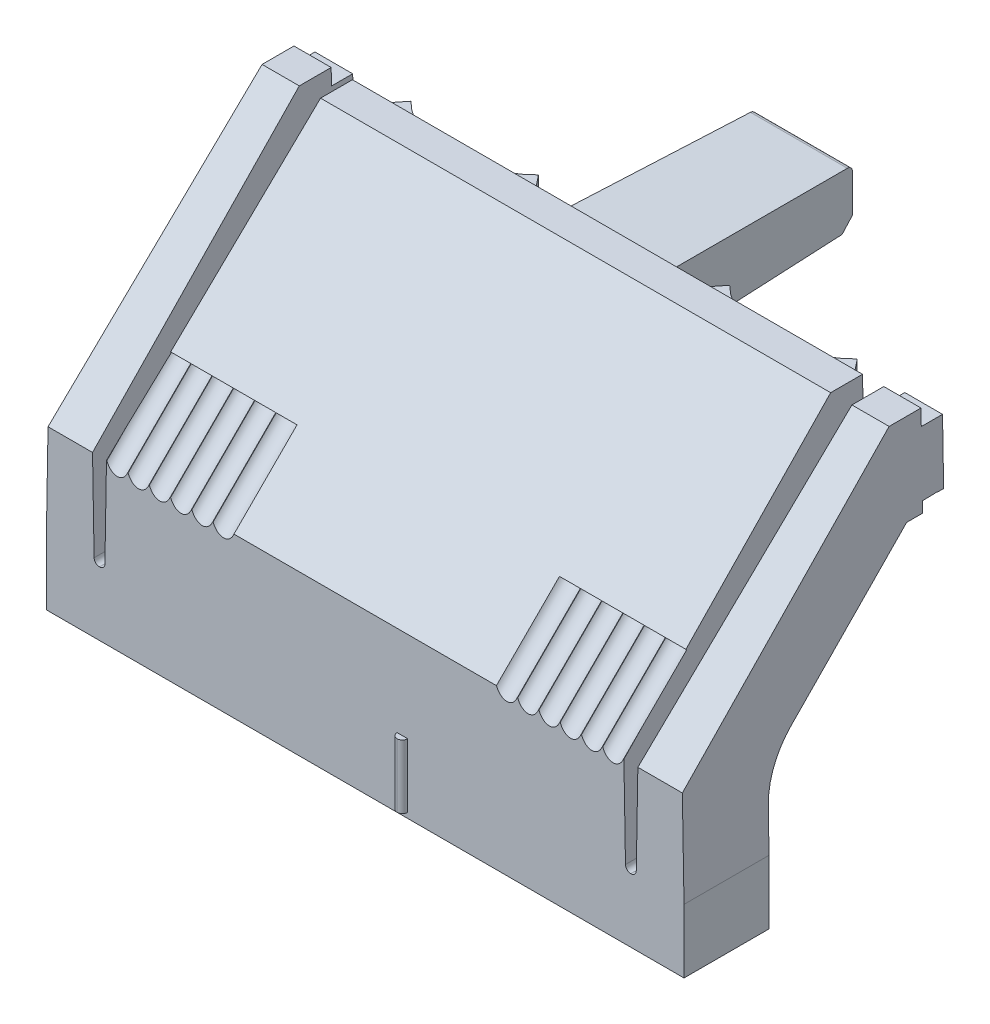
SolidWorks part; units mm, degrees
ref_plane "Plan de face" through (0, 0, 0) normal (0, 0, 1) x (1, 0, 0)
ref_plane "Plan de dessus" through (0, 0, 0) normal (0, 1, 0) x (1, 0, 0)
ref_plane "Plan de droite" through (0, 0, 0) normal (1, 0, 0) x (0, 0, -1)
sketch "Esquisse1" plane through (0, 0, 0) normal (1, 0, 0) x (0, 0, -1)
  line L0 (-4, -15) -> (4, -15)
  line L1 (-4, -15) -> (-4, 0)
  line L2 (-4, 0) -> (15.799, 19.799)
  line L3 (15.799, 19.799) -> (18.799, 19.799)
  line L4 (18.799, 19.799) -> (18.799, 4.508) construction
  line L5 (18.799, 19.799) -> (18.799, 18.299)
  line L6 (4, -15) -> (4, 11.299) construction
  line L7 (17.299, 11.299) -> (2.5901, -3.4099) construction
  line L8 (18.799, 11.299) -> (17.299, 11.299)
  line L9 (17.299, 11.299) -> (4, -1.8505)
  line L10 (4, -1.8505) -> (4, -15)
  line L11 (17.299, 15.299) -> (39.1771, 15.299) construction
  line L12 (18.799, 18.299) -> (37.299, 18.299)
  line L13 (18.799, 12.299) -> (37.299, 12.299)
  line L14 (37.299, 18.299) -> (37.299, 12.299)
  line L15 (18.799, 12.299) -> (18.799, 11.299)
  dimension "D1" = 8
  dimension "D2" = 15
  dimension "D3" = 4
  dimension "D4" = 15
  dimension "D5" = 28
  dimension "D6" = 45
  dimension "D7" = 3
  dimension "D8" = 8.5
  dimension "D9" = 18.7022
  dimension "D10" = 4.5
  dimension "D11" = 1.5
  dimension "D12" = 18.5
  dimension "D13" = 1.5
  dimension "D14" = 3
  dimension "D15" = 1
extrude "Extrusion1" add sketch "Esquisse1" along normal mid plane 60
sketch "Esquisse2" plane through (0, 18.299, 0) normal (0, 1, 0) x (-1, 0, 0)
  line L0 (0, 0) -> (0, -49.2838) construction
  line L1 (-5, -37.299) -> (5, -37.299)
  line L2 (-30, -37.299) -> (30, -37.299) construction
  line L3 (5, -37.299) -> (5, -18.799)
  line L4 (-30, -18.799) -> (30, -18.799) construction
  line L5 (5, -18.799) -> (7, -18.799)
  line L6 (7, -18.799) -> (9, -21.299)
  line L7 (9, -21.299) -> (21, -21.299)
  line L8 (21, -21.299) -> (23, -18.799)
  line L9 (23, -18.799) -> (25, -18.799)
  line L10 (25, -18.799) -> (25, -20.799)
  line L11 (25, -20.799) -> (32.5439, -20.799)
  line L13 (32.5439, -20.799) -> (32.5439, -41.148)
  line L14 (32.5439, -41.148) -> (-32.5439, -41.148)
  line L15 (-5, -18.799) -> (-7, -18.799)
  line L16 (-7, -18.799) -> (-9, -21.299)
  line L17 (-9, -21.299) -> (-21, -21.299)
  line L18 (-21, -21.299) -> (-23, -18.799)
  line L19 (-23, -18.799) -> (-25, -18.799)
  line L20 (-25, -18.799) -> (-25, -20.799)
  line L21 (-25, -20.799) -> (-32.5439, -20.799)
  line L22 (-32.5439, -20.799) -> (-32.5439, -41.148)
  line L23 (-5, -37.299) -> (-5, -18.799)
  point P3 (0, -41.148)
  point P29 (0, -37.299)
  dimension "D1" = 5
  dimension "D2" = 2
  dimension "D3" = 4
  dimension "D4" = 2.5
  dimension "D5" = 12
  dimension "D6" = 14
  dimension "D7" = 2
  dimension "D8" = 2
  dimension "D9" = 20.349
  dimension "D10" = 32.5439
extrude "Enlèv. mat.-Extru.1" cut sketch "Esquisse2" against normal through all
sketch "Esquisse3" plane through (0, 18.299, 0) normal (0, 1, 0) x (-1, 0, 0)
  line L0 (0, 0) -> (0, -43.032) construction
  line L1 (9, -21.299) -> (9, -24.2102)
  line L2 (9, -24.2102) -> (21, -24.2102)
  line L3 (21, -24.2102) -> (21, -21.299)
  line L4 (-21, -24.2102) -> (-21, -21.299)
  line L5 (-9, -24.2102) -> (-21, -24.2102)
  line L6 (-9, -21.299) -> (-9, -24.2102)
  arc A0 (9, -21.299) -> (21, -21.299) centre (15, -27.3198) cw
  arc A1 (-9, -21.299) -> (-21, -21.299) centre (-15, -27.3198) ccw
  dimension "D1" = 8.5
  dimension "D2" = 2.9113
extrude "Enlèv. mat.-Extru.2" cut sketch "Esquisse3" against normal through all
draft "Dépouille1" type of draft neutral plane draft angle 1.4 faces to draft 2 parameters "D1"=1.4
draft "Dépouille2" type of draft neutral plane draft angle 1.4 faces to draft 2 parameters "D1"=1.4
chamfer "Chanfrein1" distance 1 angle 45 1 edges at (0, 12.7511, -37.299)
sketch "Esquisse4" plane through (0, 11.8325, 0.2892) normal (0, -0.9997, -0.0244) x (1, 0, 0)
  line L0 (0, 0) -> (0, -42.5855) construction
  line L1 (4.5479, -37.6244) -> (-4.5479, -37.6244) construction
  line L2 (2.5, -31.6244) -> (-2.5, -31.6244)
  line L3 (2.5, -31.6244) -> (2.5, -34.6244)
  line L4 (2.5, -34.6244) -> (-2.5, -34.6244)
  line L5 (-2.5, -31.6244) -> (-2.5, -34.6244)
  dimension "D1" = 3
  dimension "D2" = 3
  dimension "D3" = 5
  dimension "D4" = 5
extrude "Enlèv. mat.-Extru.3" cut sketch "Esquisse4" against normal blind 3
fillet "Congé1" radius 0.5 1 edges at (0, 17.8469, -37.299)
sketch "Esquisse5" plane through (0, 0, 4) normal (0, 0, 1) x (1, 0, 0)
  line L0 (0, 23.5106) -> (0, -19.7744) construction
  line L1 (-29.5, 19.799) -> (-26, 19.799)
  line L2 (30, 19.799) -> (-30, 19.799) construction
  line L3 (-30, -9) -> (-29.5, 19.799)
  line L6 (-30, 0) -> (-30, -15) construction
  line L7 (30, -15) -> (-30, -15) construction
  line L8 (-30, 19.799) -> (-30, 0) construction
  line L9 (-26, 19.799) -> (-25.5, -9)
  line L10 (-24.5, -9) -> (-24, 19.799)
  line L11 (-25.5, -9) -> (-24.5, -9)
  line L12 (-30, -9) -> (-30, 28.654)
  line L13 (-30, 28.654) -> (-24, 28.654)
  line L14 (-24, 28.654) -> (-24, 19.799)
  line L15 (25.5, -9) -> (24.5, -9)
  line L16 (24, 28.654) -> (24, 19.799)
  line L17 (24.5, -9) -> (24, 19.799)
  line L18 (26, 19.799) -> (25.5, -9)
  line L19 (29.5, 19.799) -> (26, 19.799)
  line L20 (30, 28.654) -> (24, 28.654)
  line L21 (30, -9) -> (29.5, 19.799)
  line L22 (30, -9) -> (30, 28.654)
  dimension "D1" = 6
  dimension "D2" = 0.5
  dimension "D3" = 6
  dimension "D4" = 1
  dimension "D5" = 6
  dimension "D6" = 3.5
  dimension "D7" = 2
  dimension "D8" = 4.5
  dimension "D9" = 8.855
extrude "Enlèv. mat.-Extru.4" cut sketch "Esquisse5" against normal through all
fillet "Congé2" radius 0.5 4 edges at (25.5, -9, 0) (24.5, -9, 0) (-24.5, -9, 0) (-25.5, -9, 0)
sketch "Esquisse8" plane through (0, -2.9356, -2.9026) normal (0, -0.7111, -0.7031) x (1, 0, 0)
  line L0 (0, 15.8392) -> (0, -27.2885) construction
  line L1 (24, -27.2885) -> (-24, -27.2885) construction
  line L2 (24.3759, -1.5433) -> (-24.3759, -1.5433) construction
  line L3 (2, -23.0469) -> (-2, -23.0469)
  line L4 (2, -23.0469) -> (2, 9.9625)
  line L5 (2, 9.9625) -> (-2, 9.9625)
  line L6 (-2, -23.0469) -> (-2, 9.9625)
  dimension "D1" = 4
  dimension "D2" = 33.0094
  dimension "D3" = 2
  dimension "D4" = 11.5058
extrude "Extrusion3" add sketch "Esquisse8" along normal blind 7
sketch "Esquisse9" plane through (-2, 0, 0) normal (-1, 0, 0) x (0, 0, 1)
  line L0 (-18.799, 12.299) -> (-18.799, 2.9381)
  line L1 (-4, -11.6945) -> (-24.2127, 8.291) construction
  line L2 (-18.799, 12.299) -> (-20.2156, 12.3336)
  line L3 (-20.2156, 12.3336) -> (-26.1871, 6.2942)
  line L4 (-14.2087, -9) -> (0, -9) construction
  line L5 (4, -15) -> (-4, -15) construction
  line L6 (-4, -9) -> (-6.7252, -9)
  line L7 (-6.7252, -9) -> (-18.799, 2.9381)
  line L8 (-4, -9) -> (-4, -12.4993)
  line L9 (-4, -15) -> (-4, -9) construction
  line L10 (-4, -12.4993) -> (-6.7252, -12.8306)
  line L11 (-6.7252, -12.8306) -> (-26.1871, 6.2942)
  dimension "D1" = 6
  dimension "D2" = 2.7252
  dimension "D3" = 16.9793
  dimension "D4" = 2.7452
  dimension "D5" = 27.286
  dimension "D6" = 8.4932
extrude "Enlèv. mat.-Extru.5" cut sketch "Esquisse9" against normal through all
ref_plane "Plan2" through (0, -9.5, 9.5) normal (0, -0.7071, 0.7071) x (1, 0, 0)
sketch "Esquisse12" plane through (0, -9.5, 9.5) normal (0, -0.7071, 0.7071) x (1, 0, 0)
  line L0 (-24.3295, 2.8608) -> (-24.3295, 7.2103)
  line L1 (-12.3295, 2.8608) -> (-12.3295, 7.2103)
  line L2 (-12.3295, 7.2103) -> (-24.3295, 7.2103)
  line L3 (0, -1.5673) -> (0, 17.1731) construction
  line L4 (12.3295, 2.8608) -> (12.3295, 7.2103)
  line L5 (12.3295, 7.2103) -> (24.3295, 7.2103)
  line L6 (24.3295, 2.8608) -> (24.3295, 7.2103)
  arc A0 (-24.3295, 2.8608) -> (-22.3295, 2.8608) centre (-23.3295, 3.4009) ccw
  arc A1 (-22.3295, 2.8608) -> (-20.3295, 2.8608) centre (-21.3295, 3.4009) ccw
  arc A2 (-20.3295, 2.8608) -> (-18.3295, 2.8608) centre (-19.3295, 3.4009) ccw
  arc A3 (-18.3295, 2.8608) -> (-16.3295, 2.8608) centre (-17.3295, 3.4009) ccw
  arc A4 (-16.3295, 2.8608) -> (-14.3295, 2.8608) centre (-15.3295, 3.4009) ccw
  arc A5 (-14.3295, 2.8608) -> (-12.3295, 2.8608) centre (-13.3295, 3.4009) ccw
  arc A6 (14.3295, 2.8608) -> (12.3295, 2.8608) centre (13.3295, 3.4009) cw
  arc A7 (16.3295, 2.8608) -> (14.3295, 2.8608) centre (15.3295, 3.4009) cw
  arc A8 (18.3295, 2.8608) -> (16.3295, 2.8608) centre (17.3295, 3.4009) cw
  arc A9 (20.3295, 2.8608) -> (18.3295, 2.8608) centre (19.3295, 3.4009) cw
  arc A10 (22.3295, 2.8608) -> (20.3295, 2.8608) centre (21.3295, 3.4009) cw
  arc A11 (24.3295, 2.8608) -> (22.3295, 2.8608) centre (23.3295, 3.4009) cw
  dimension "D2" = 1.1366
  dimension "D5" = 5.5143
  dimension "D1" = 2
  dimension "D3" = 4.3496
  dimension "D4" = 12
extrude "Enlèv. mat.-Extru.6" cut sketch "Esquisse12" against normal blind 19
sketch "Esquisse13" plane through (2, 0, 0) normal (1, 0, 0) x (0, 0, -1)
  line L0 (-4, -9.7606) -> (-4.1817, -9.9402)
  line L1 (-4.1817, -9.9402) -> (-4, -10.1239)
  line L2 (-4, -10.1239) -> (-4, -9.7606)
extrude "Enlèv. mat.-Extru.7" cut sketch "Esquisse13" against normal through all
sketch "Esquisse14" plane through (0, 0, 4) normal (0, 0, 1) x (1, 0, 0)
  line L0 (30, -9) -> (30, -15) construction
  line L1 (3, -8.5) -> (4, -8.5)
  line L2 (3, -8.5) -> (3, -14.5)
  line L3 (3, -14.5) -> (4, -14.5)
  line L4 (4, -8.5) -> (4, -14.5)
  line L5 (30, -15) -> (-30, -15) construction
  point P4 (30, -12)
  dimension "D1" = 1
  dimension "D2" = 26
  dimension "D3" = 0.5
  dimension "D4" = 6
extrude "Extrusion4" add sketch "Esquisse14" along normal blind 0.5
fillet "Congé3" radius 0.5 2 edges at (3, -11.5, 4.5) (4, -11.5, 4.5)
sketch "Esquisse15" plane through (0, 0, -4) normal (0, 0, -1) x (-1, 0, 0)
  line L0 (0, 0) -> (0, -27.609) construction
  line L1 (-30, -15) -> (30, -15) construction
  line L2 (-29, -9) -> (-28, -9)
  line L3 (-29, -9) -> (-29, 4.4636)
  line L4 (-29, 4.4636) -> (-28, 4.4636)
  line L5 (-28, -9) -> (-28, 4.4636)
  line L6 (-30, -15) -> (-30, -9) construction
  line L7 (29, 4.4636) -> (28, 4.4636)
  line L8 (28, -9) -> (28, 4.4636)
  line L9 (29, -9) -> (29, 4.4636)
  line L10 (29, -9) -> (28, -9)
  dimension "D1" = 6
  dimension "D2" = 1
  dimension "D3" = 1
extrude "Extrusion5" add sketch "Esquisse15" along normal blind 1
fillet "Congé4" radius 0.5 4 edges at (-29, -4.9309, -5) (-28, -4.9309, -5) (28, -4.9309, -5) (29, -4.9309, -5)
fillet "Congé5" radius 7.5 1 edges at (-13.1879, -1.8505, -4)
fillet "Congé7" radius 7.5 1 edges at (-26.8121, -1.8505, -4)
fillet "Congé8" radius 7.5 2 edges at (26.8121, -1.8505, -4) (13.1879, -1.8505, -4)
